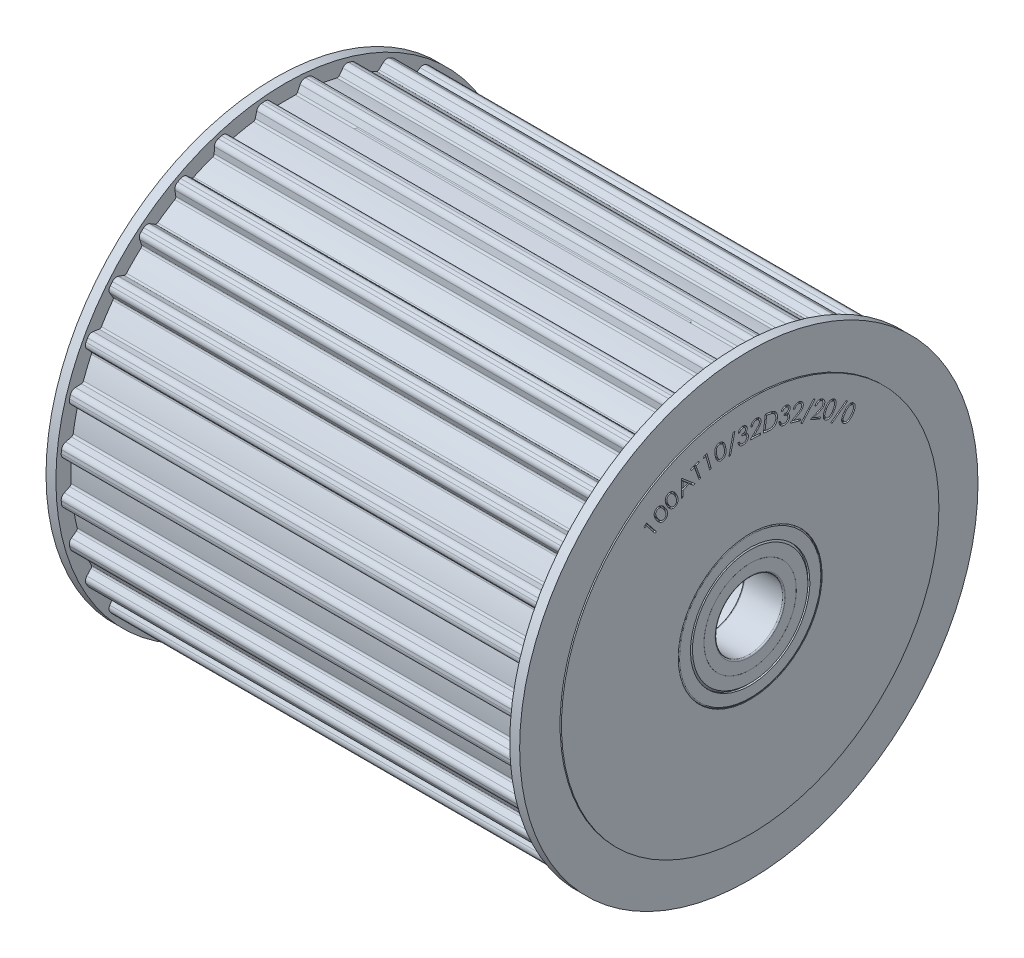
SolidWorks part; units mm, degrees
ref_plane "Front Plane" through (0, 0, 0) normal (0, 0, 1) x (1, 0, 0)
ref_plane "Top Plane" through (0, 0, 0) normal (0, 1, 0) x (1, 0, 0)
ref_plane "Right Plane" through (0, 0, 0) normal (1, 0, 0) x (0, 0, -1)
imported_body "3.2033 hammashihnapyörä  100AT10_32D32_20_0-1-solid1"
imported_body "4.0001 Laakeri 6002 ZZ LBS-1-solid1"
imported_body "4.0001 Laakeri 6002 ZZ LBS-1-solid2"
imported_body "4.0001 Laakeri 6002 ZZ LBS-1-solid3"
imported_body "4.0001 Laakeri 6002 ZZ LBS-1-solid4"
imported_body "4.0001 Laakeri 6002 ZZ LBS-1-solid5"
imported_body "4.0001 Laakeri 6002 ZZ LBS-1-solid6"
imported_body "4.0001 Laakeri 6002 ZZ LBS-1-solid7"
imported_body "4.0001 Laakeri 6002 ZZ LBS-1-solid8"
imported_body "4.0001 Laakeri 6002 ZZ LBS-1-solid9"
imported_body "4.0001 Laakeri 6002 ZZ LBS-1-solid10"
imported_body "4.0001 Laakeri 6002 ZZ LBS-1-solid11"
imported_body "4.0001 Laakeri 6002 ZZ LBS-1-solid12"
imported_body "4.0001 Laakeri 6002 ZZ LBS-1-solid13"
imported_body "4.0001 Laakeri 6002 ZZ LBS-1-solid14"
imported_body "4.0001 Laakeri 6002 ZZ LBS-2-solid1"
imported_body "4.0001 Laakeri 6002 ZZ LBS-2-solid2"
imported_body "4.0001 Laakeri 6002 ZZ LBS-2-solid3"
imported_body "4.0001 Laakeri 6002 ZZ LBS-2-solid4"
imported_body "4.0001 Laakeri 6002 ZZ LBS-2-solid5"
imported_body "4.0001 Laakeri 6002 ZZ LBS-2-solid6"
imported_body "4.0001 Laakeri 6002 ZZ LBS-2-solid7"
imported_body "4.0001 Laakeri 6002 ZZ LBS-2-solid8"
imported_body "4.0001 Laakeri 6002 ZZ LBS-2-solid9"
imported_body "4.0001 Laakeri 6002 ZZ LBS-2-solid10"
imported_body "4.0001 Laakeri 6002 ZZ LBS-2-solid11"
imported_body "4.0001 Laakeri 6002 ZZ LBS-2-solid12"
imported_body "4.0001 Laakeri 6002 ZZ LBS-2-solid13"
imported_body "4.0001 Laakeri 6002 ZZ LBS-2-solid14"
sketch "Sketch1" plane through (741.4619, 0, 0) normal (1, 0, 0) x (0, 0, -1)
  circle A0 centre (-1252.199, 870.5258) radius 42
  circle A1 centre (-1252.199, 870.5258) radius 51
extrude "Boss-Extrude1" add sketch "Sketch1" against normal blind 2.2
sketch "Sketch2" plane through (636.0619, 0, 0) normal (-1, 0, 0) x (0, 0, 1)
  circle A0 centre (1252.199, 870.5258) radius 42
  circle A1 centre (1252.199, 870.5258) radius 51
extrude "Boss-Extrude2" add sketch "Sketch2" against normal blind 2.2
sketch "Sketch3" plane through (741.7619, 0, 0) normal (1, 0, 0) x (0, 0, -1)
  circle A0 centre (-1252.199, 870.5258) radius 34 construction
  text T0 "100AT10/32D32/20/0                      "
extrude "Cut-Extrude1" cut sketch "Sketch3" against normal blind 0.5
